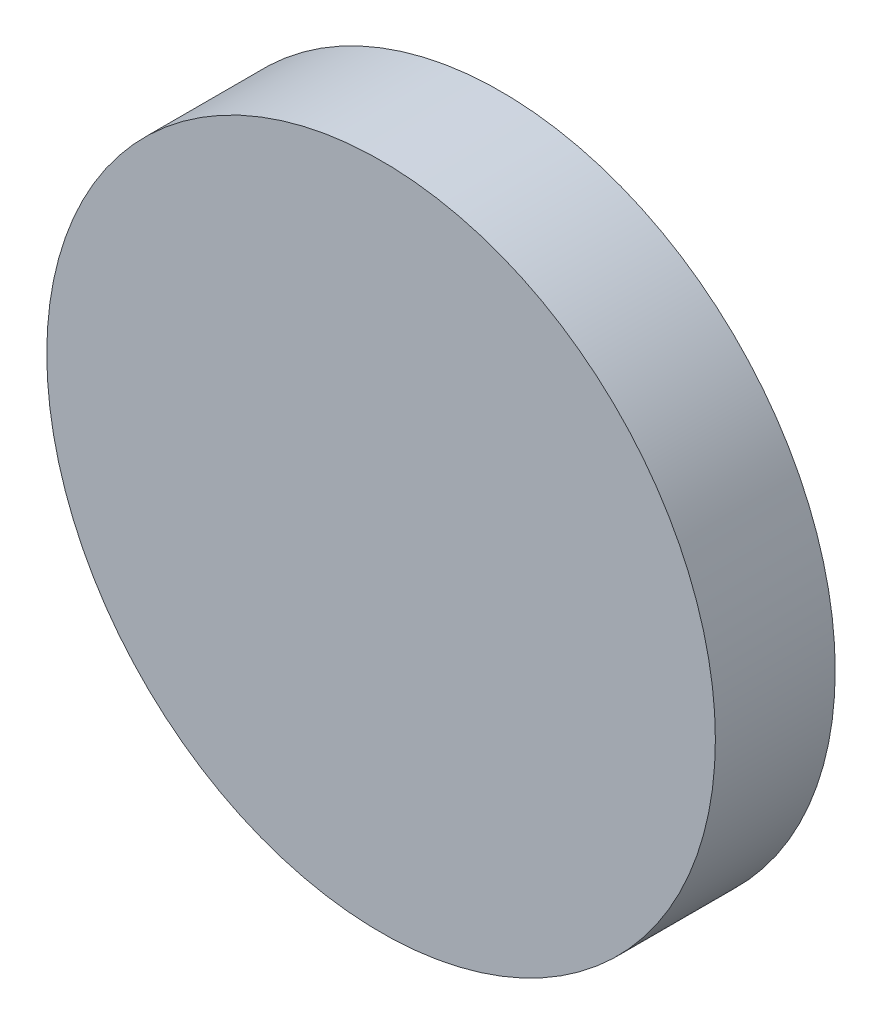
SolidWorks part; units mm, degrees
ref_plane "Front Plane" through (0, 0, 0) normal (0, 0, 1) x (1, 0, 0)
ref_plane "Top Plane" through (0, 0, 0) normal (0, 1, 0) x (1, 0, 0)
ref_plane "Right Plane" through (0, 0, 0) normal (1, 0, 0) x (0, 0, -1)
sketch "Sketch1" plane through (0, 0, 0) normal (0, 0, 1) x (1, 0, 0)
  circle A0 centre (0, 0) radius 5.3
  dimension "D1" = 10.6
extrude "Boss-Extrude1" add sketch "Sketch1" along normal blind 1.9
